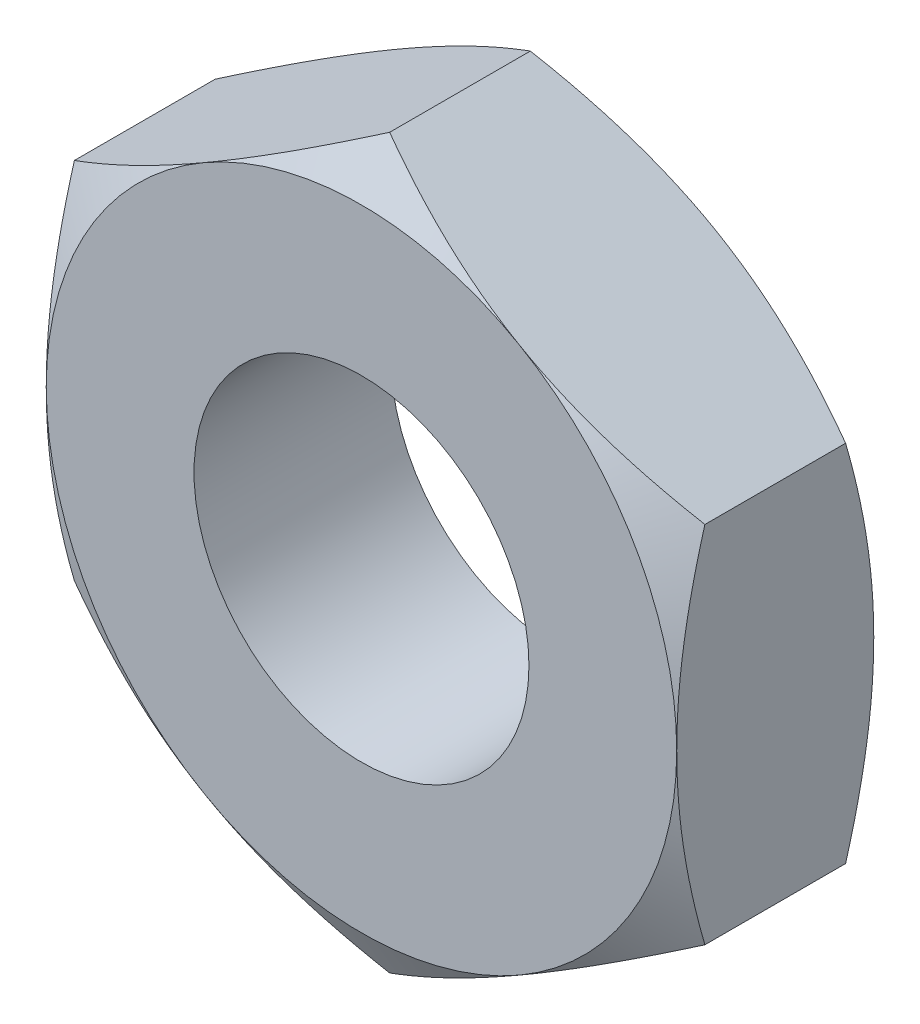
SolidWorks part; units mm, degrees
ref_plane "Plane1" through (0, 0, 0) normal (0, 0, 1) x (1, 0, 0)
ref_plane "Plane2" through (0, 0, 0) normal (0, 1, 0) x (1, 0, 0)
ref_plane "Plane3" through (0, 0, 0) normal (1, 0, 0) x (0, 0, -1)
sketch "BaseNutSke" plane through (0, 0, 0) normal (0, 0, 1) x (1, 0, 0)
  line L6 (8, 4.6188) -> (8, -4.6188)
  line L7 (-8, 4.6188) -> (-8, -4.6188)
  line L8 (8, 4.6188) -> (0, 9.2376)
  line L9 (0, 9.2376) -> (-8, 4.6188)
  line L10 (-8, -4.6188) -> (0, -9.2376)
  line L11 (0, -9.2376) -> (8, -4.6188)
  circle A0 centre (0, 0) radius 2.5
  dimension "D4" = 8
  dimension "Tap_drill" = 5
  dimension "D1" = 120
  dimension "D2" = 8
  dimension "D3" = 8
  dimension "Width_flats" = 16
extrude "BaseNut" add sketch "BaseNutSke" against normal blind 5
sketch "Esquisse1" plane through (0, 0, 0) normal (1, 0, 0) x (0, 0, -1)
  line L0 (4.2855, 9.2376) -> (5, 8)
  line L1 (5, 9.2376) -> (0, 9.2376) construction
  line L2 (5, 4.6188) -> (5, 9.2376) construction
  line L3 (5, 8) -> (5, 9.2376)
  line L4 (5, 9.2376) -> (4.2855, 9.2376)
  line L5 (0, 9.2376) -> (0, 8)
  line L6 (0, 4.6188) -> (0, 9.2376) construction
  line L7 (0, 8) -> (0.7145, 9.2376)
  line L8 (0.7145, 9.2376) -> (0, 9.2376)
  dimension "D1" = 30
  dimension "D2" = 30
  dimension "D3" = 8
revolve "Enlèvement de matière-Révolution1" cut sketch "Esquisse1" angle 360 about axis through (0, 0, -5) along (0, 0, 1)
hole_wizard "Trou taraudé M101" positions "Esquisse3" profile "Esquisse2" tap size "M10" standard "ISO"
sketch "Esquisse3" plane through (0, 0, 0) normal (0, 0, 1) x (1, 0, 0)
  point P0 (0, 0)
sketch "Esquisse2" plane through (0, 0, 0) normal (1, 0, 0) x (0, -1, 0)
  line L0 (0, 0) -> (0, 5)
  line L1 (0, 5) -> (4.25, 5)
  line L2 (4.25, 5) -> (4.25, 0)
  line L5 (4.25, 0) -> (0, 0)
  line L11 (0, -6.35) -> (0, 107.95) construction
  dimension "Diamètre du trou pour taraudage jusqu'au prochain" = 8.5
  dimension "Profondeur du trou pour taraudage jusqu'au prochain" = 5
